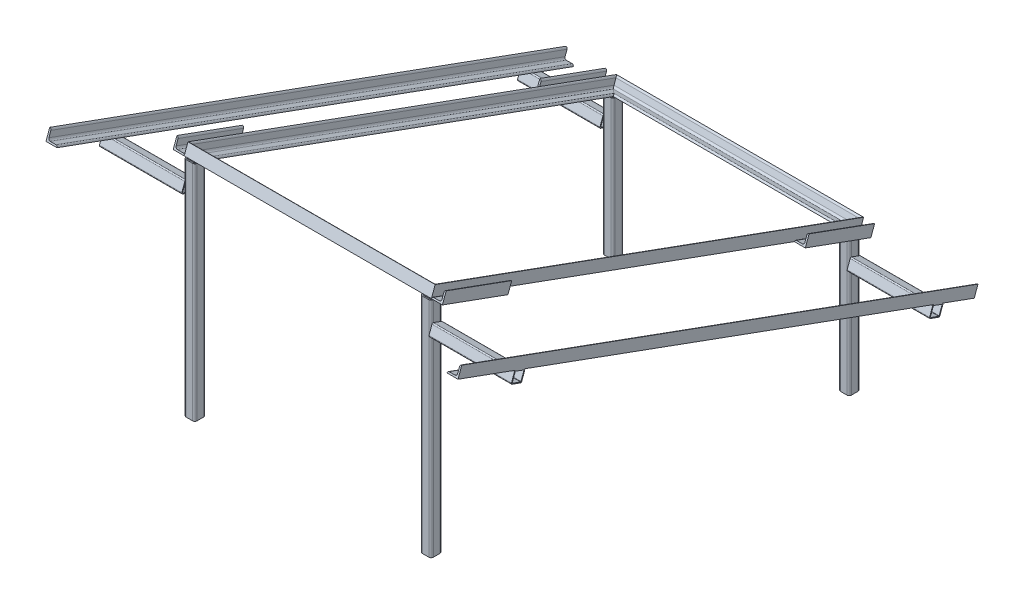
SolidWorks part; units mm, degrees
ref_plane "Front Plane" through (0, 0, 0) normal (0, 0, 1) x (1, 0, 0)
ref_plane "Top Plane" through (0, 0, 0) normal (0, 1, 0) x (1, 0, 0)
ref_plane "Right Plane" through (0, 0, 0) normal (1, 0, 0) x (0, 0, -1)
sketch "Sketch1" plane through (0, 0, 0) normal (0, 1, 0) x (1, 0, 0)
  line L0 (0, 0) -> (-50000, 0) construction
ref_plane "Plane1" through (0, 0, 0) normal (0, 0.9397, -0.342) x (-1, 0, 0)
sketch "Sketch2" plane through (0, 0, 0) normal (0, 0.9397, -0.342) x (-1, 0, 0)
  line L1 (-225, -415) -> (225, -415)
  line L2 (-225, -415) -> (-225, 415)
  line L3 (-225, 415) -> (225, 415)
  line L4 (225, -415) -> (225, 415)
  line L5 (-225, -415) -> (225, 415) construction
  line L6 (-225, 415) -> (225, -415) construction
  point P0 (0, 0)
  dimension "D1" = 830
  dimension "D2" = 450
other "Angle iron 20 X 20 X 3(1)"
ref_plane "Plane3" through (225, 141.9384, 389.9724) normal (-1, 0, 0) x (0, 0.9397, -0.342)
sketch "Sketch12" plane through (225, 141.9384, 389.9724) normal (-1, 0, 0) x (0, 0.9397, -0.342)
  line L0 (0, 0) -> (0, 20)
  line L1 (0, 10) -> (3, 10) construction
  line L2 (3, 17) -> (3, 6.5)
  line L3 (6.5, 3) -> (17, 3)
  line L4 (10, 3) -> (10, 0) construction
  line L5 (20, 0) -> (0, 0)
  arc A0 (20, 0) -> (17, 3) centre (17, 0) ccw
  arc A1 (0, 20) -> (3, 17) centre (0, 17) cw
  arc A2 (6.5, 3) -> (3, 6.5) centre (6.5, 6.5) cw
  point P10 (10, 0)
  point P14 (0, 10)
  point P15 (3, 10)
  point P16 (10, 3)
  point P17 (3, 20)
  point P18 (20, 3)
  point P21 (0, 0)
  dimension "D2" = 3
  dimension "D3" = 20
  dimension "Radius_1" = 3.5
  dimension "D1" = 3
sketch3d "3DSketch1"
  line L0 (225, 141.9384, 389.9724) -> (225, -264.0616, 389.9724)
  line L1 (225, 141.9384, 389.9724) -> (-225, -141.9384, -389.9724) construction
  line L2 (225, -141.9384, -389.9724) -> (225, 141.9384, 389.9724) construction
  line L3 (225, -141.9384, -389.9724) -> (225, -395.9384, -389.9724)
  line L4 (225, -141.9384, -389.9724) -> (-225, 141.9384, 389.9724) construction
  line L5 (-215, -138.5182, -380.5755) -> (-215, -392.5182, -380.5755)
  line L6 (-215, 138.5182, 380.5755) -> (-215, -267.4818, 380.5755)
  line L10 (-225, 141.9384, 389.9724) -> (-205, 135.098, 371.1786) construction
  line L11 (-225, -141.9384, -389.9724) -> (-205, -135.098, -371.1786) construction
  dimension "D1" = 406
  dimension "D2" = 254
other "Square tube 20 X 20 X 2(1)"
ref_plane "Plane5" through (-215, 138.5182, 380.5755) normal (0, -1, 0) x (1, 0, 0)
sketch "Sketch14" plane through (-215, 138.5182, 380.5755) normal (0, -1, 0) x (1, 0, 0)
  line L0 (-6, -8) -> (6, -8)
  line L1 (-8, -6) -> (-8, 6)
  line L2 (6, 8) -> (-6, 8)
  line L3 (8, 6) -> (8, -6)
  line L4 (-6, -10) -> (6, -10)
  line L5 (-10, -6) -> (-10, 6)
  line L6 (6, 10) -> (-6, 10)
  line L7 (10, 6) -> (10, -6)
  arc A0 (10, 6) -> (6, 10) centre (6, 6) ccw
  arc A1 (6, -10) -> (10, -6) centre (6, -6) ccw
  arc A2 (-10, -6) -> (-6, -10) centre (-6, -6) ccw
  arc A3 (-6, 10) -> (-10, 6) centre (-6, 6) ccw
  arc A4 (-6, 8) -> (-8, 6) centre (-6, 6) ccw
  arc A5 (8, 6) -> (6, 8) centre (6, 6) ccw
  arc A6 (6, -8) -> (8, -6) centre (6, -6) ccw
  arc A7 (-8, -6) -> (-6, -8) centre (-6, -6) ccw
  point P0 (-10, 0)
  point P1 (10, 0)
  point P2 (0, 10)
  point P3 (0, -10)
  point P4 (0, 0)
  point P5 (-10, -10)
  point P6 (10, -10)
  point P7 (10, 10)
  point P8 (-10, 10)
  point P33 (0, 0)
  dimension "D1" = 4
  dimension "Thickness" = 2
  dimension "V_leg" = 20
mirror "Mirror1" about plane through (0, 0, 0) normal (1, 0, 0)
sketch "Sketch16" plane through (-225, 0, 0) normal (-1, 0, 0) x (0, 0, 1)
  line L0 (389.9724, 141.9384) -> (270.6315, 98.5018)
  line L1 (-389.9724, -141.9384) -> (389.9724, 141.9384) construction
  dimension "D1" = 127
sketch "Sketch17" plane through (0, 0, 0) normal (0, 0.9397, -0.342) x (-1, 0, 0)
  line L0 (245, 415) -> (245, 288)
  line L2 (225, 415) -> (-225, 415) construction
  line L3 (245, -415) -> (245, -288)
  line L4 (-225, -415) -> (225, -415) construction
  dimension "D1" = 127
  dimension "D2" = 20
  dimension "D3" = 127
other "Angle iron 20 X 20 X 3(4)"
ref_plane "Plane8" through (-245, 141.9384, 389.9724) normal (0, -0.342, -0.9397) x (0, 0.9397, -0.342)
sketch "Sketch19" plane through (-245, 141.9384, 389.9724) normal (0, -0.342, -0.9397) x (0, 0.9397, -0.342)
  line L0 (0, 0) -> (0, 20)
  line L1 (0, 10) -> (3, 10) construction
  line L2 (3, 17) -> (3, 6.5)
  line L3 (6.5, 3) -> (17, 3)
  line L4 (10, 3) -> (10, 0) construction
  line L5 (20, 0) -> (0, 0)
  arc A0 (20, 0) -> (17, 3) centre (17, 0) ccw
  arc A1 (0, 20) -> (3, 17) centre (0, 17) cw
  arc A2 (6.5, 3) -> (3, 6.5) centre (6.5, 6.5) cw
  point P10 (10, 0)
  point P14 (0, 10)
  point P15 (3, 10)
  point P16 (10, 3)
  point P17 (3, 20)
  point P18 (20, 3)
  point P21 (0, 0)
  dimension "D2" = 3
  dimension "D3" = 20
  dimension "Radius_1" = 3.5
  dimension "D1" = 3
ref_plane "Plane13" through (0, -33.8289, 12.3127) normal (0, -0.9397, 0.342) x (-1, 0, 0)
mirror "Mirror3" about plane through (0, 0, 0) normal (1, 0, 0)
sketch "Sketch20" plane through (0, -33.8289, 12.3127) normal (0, 0.9397, -0.342) x (-1, 0, 0)
  line L0 (375, 510) -> (375, -490)
  line L1 (245, 288) -> (245, 415) construction
  line L2 (-225, -415) -> (225, -415) construction
  dimension "D1" = 130
  dimension "D2" = 1000
  dimension "D3" = 75
other "Angle iron 20 X 20 X 3(7)"
ref_plane "Plane10" through (-375, 140.6013, 491.556) normal (0, -0.342, -0.9397) x (0, 0.9397, -0.342)
sketch "Sketch111" plane through (-375, 140.6013, 491.556) normal (0, -0.342, -0.9397) x (0, 0.9397, -0.342)
  line L0 (0, 0) -> (0, 20)
  line L1 (0, 10) -> (3, 10) construction
  line L2 (3, 17) -> (3, 6.5)
  line L3 (6.5, 3) -> (17, 3)
  line L4 (10, 3) -> (10, 0) construction
  line L5 (20, 0) -> (0, 0)
  arc A0 (20, 0) -> (17, 3) centre (17, 0) ccw
  arc A1 (0, 20) -> (3, 17) centre (0, 17) cw
  arc A2 (6.5, 3) -> (3, 6.5) centre (6.5, 6.5) cw
  point P10 (10, 0)
  point P14 (0, 10)
  point P15 (3, 10)
  point P16 (10, 3)
  point P17 (3, 20)
  point P18 (20, 3)
  point P21 (0, 0)
  dimension "D2" = 3
  dimension "D3" = 20
  dimension "Radius_1" = 3.5
  dimension "D1" = 3
mirror "Mirror4" about plane through (0, 0, 0) normal (1, 0, 0)
sketch "Sketch112" plane through (-375, 0, 0) normal (-1, 0, 0) x (0, 0, 1)
  line L0 (-389.8757, -180.2136) -> (-374.8406, -174.7412)
  line L1 (-391.0711, -182.777) -> (-385.5987, -197.8121)
  line L2 (-372.2772, -175.9366) -> (-366.8049, -190.9717)
  line L3 (-383.0353, -199.0074) -> (-368.0002, -193.5351)
  line L4 (-448.1367, -201.4188) -> (491.556, 140.6013) construction
  line L5 (-389.3627, -181.6231) -> (-374.3276, -176.1508)
  line L6 (-373.6867, -176.4496) -> (-368.2144, -191.4847)
  line L7 (-383.5483, -197.5979) -> (-368.5133, -192.1255)
  line L8 (-389.6615, -182.264) -> (-384.1892, -197.299)
  line L9 (371.2753, 96.8228) -> (386.3104, 102.2951)
  line L10 (370.08, 94.2593) -> (375.5523, 79.2243)
  line L11 (388.8738, 101.0997) -> (394.3461, 86.0647)
  line L12 (378.1157, 78.0289) -> (393.1508, 83.5012)
  line L17 (371.7883, 95.4132) -> (386.8234, 100.8855)
  line L18 (387.4643, 100.5867) -> (392.9366, 85.5516)
  line L19 (377.6027, 79.4384) -> (392.6378, 84.9108)
  line L20 (371.4895, 94.7724) -> (376.9618, 79.7373)
  arc A0 (-385.5987, -197.8121) -> (-383.0353, -199.0074) centre (-383.7194, -197.128) ccw
  arc A1 (-374.8406, -174.7412) -> (-372.2772, -175.9366) centre (-374.1566, -176.6206) cw
  arc A2 (-391.0711, -182.777) -> (-389.8757, -180.2136) centre (-389.1917, -182.0929) cw
  arc A3 (-366.8049, -190.9717) -> (-368.0002, -193.5351) centre (-368.6843, -191.6557) cw
  arc A4 (-374.3276, -176.1508) -> (-373.6867, -176.4496) centre (-374.1566, -176.6206) cw
  arc A5 (-368.2144, -191.4847) -> (-368.5133, -192.1255) centre (-368.6843, -191.6557) cw
  arc A6 (-384.1892, -197.299) -> (-383.5483, -197.5979) centre (-383.7194, -197.128) ccw
  arc A7 (-389.6615, -182.264) -> (-389.3627, -181.6231) centre (-389.1917, -182.0929) cw
  arc A8 (375.5523, 79.2243) -> (378.1157, 78.0289) centre (377.4317, 79.9083) ccw
  arc A9 (386.3104, 102.2951) -> (388.8738, 101.0997) centre (386.9944, 100.4157) cw
  arc A10 (370.08, 94.2593) -> (371.2753, 96.8228) centre (371.9593, 94.9434) cw
  arc A11 (394.3461, 86.0647) -> (393.1508, 83.5012) centre (392.4668, 85.3806) cw
  arc A16 (386.8234, 100.8855) -> (387.4643, 100.5867) centre (386.9944, 100.4157) cw
  arc A17 (392.9366, 85.5516) -> (392.6378, 84.9108) centre (392.4668, 85.3806) cw
  arc A18 (376.9618, 79.7373) -> (377.6027, 79.4384) centre (377.4317, 79.9083) ccw
  arc A19 (371.4895, 94.7724) -> (371.7883, 95.4132) centre (371.9593, 94.9434) cw
  point P6 (-384.9147, -199.6914)
  point P11 (-372.9612, -174.0572)
  point P14 (-377.6597, -175.7673)
  point P17 (-366.1208, -192.851)
  point P31 (-382.3582, -177.4774)
  point P42 (383.7846, 101.3937)
  point P57 (378.7928, 99.5589)
  dimension "D3" = 2
  dimension "D6" = 2
  dimension "D10" = 1.5
  dimension "D1" = 20
  dimension "D2" = 20
  dimension "D5" = 70
  dimension "D7" = 0
  dimension "D8" = 20
  dimension "D9" = 20
  dimension "D11" = 120
  dimension "D4" = 1.5
extrude "Boss-Extrude1" add sketch "Sketch112" against normal up to surface (150 mm away) separate body
ref_plane "Plane11" through (0, 0, 0) normal (0, 0.342, 0.9397) x (1, 0, 0)
mirror "Mirror5" about plane through (0, 0, 0) normal (1, 0, 0) of "Boss-Extrude1"
